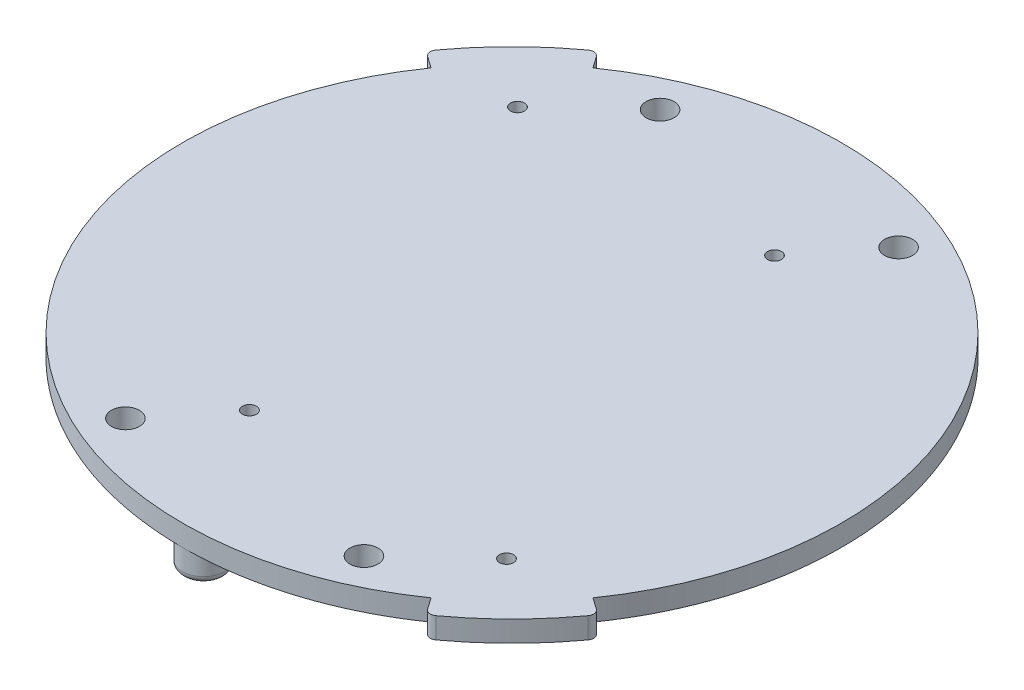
SolidWorks part; units mm, degrees
other "<a_base>-<Holes Pattern>"
ref_plane "Front Plane" through (0, 0, 0) normal (0, 0, 1) x (1, 0, 0)
ref_plane "Top Plane" through (0, 0, 0) normal (0, 1, 0) x (1, 0, 0)
ref_plane "Right Plane" through (0, 0, 0) normal (1, 0, 0) x (0, 0, -1)
inserted part "a_base"
sketch "Sketch1" plane through (0, -1.5, 0) normal (0, -1, 0) x (1, 0, 0)
  line L0 (27.5, 28.2843) -> (-9.1667, 28.2843) construction
  line L1 (9.1667, -28.2843) -> (-27.5, -28.2843) construction
  line L2 (9.1667, 28.2843) -> (-9.1667, -28.2843) construction
  line L3 (0, 0) -> (-44.7105, 14.4903) construction
  line L4 (0.1764, 16.7621) -> (-7.4339, 19.2286)
  line L5 (-7.4339, 19.2286) -> (-17.2996, -11.2127)
  line L6 (1.1013, 19.616) -> (-35.0366, 31.3279)
  line L7 (-20.1535, -10.2878) -> (-10.2878, 20.1535)
  line L8 (-10.2878, 20.1535) -> (-26.4596, 25.3946)
  line L9 (-26.4596, 25.3946) -> (-36.3254, -5.0466)
  line L10 (-39.1792, -4.1217) -> (-29.3135, 26.3195)
  line L11 (-29.3135, 26.3195) -> (-37.1072, 28.8454)
  line L12 (-7.4339, 19.2286) -> (-10.2878, 20.1535) construction
  line L13 (-26.4596, 25.3946) -> (-29.3135, 26.3195) construction
  line L14 (1.1013, 19.616) -> (0.1764, 16.7621)
  line L15 (-39.1792, -4.1217) -> (-46.9729, -1.5958)
  line L16 (-20.1535, -10.2878) -> (-36.3254, -5.0466)
  line L17 (-9.6893, -13.6791) -> (-17.2996, -11.2127)
  line L18 (-10.6142, -16.533) -> (-46.7521, -4.821)
  line L19 (-10.6142, -16.533) -> (-9.6893, -13.6791)
  circle A0 centre (0, 0) radius 47 construction
  arc A1 (-35.0366, 31.3279) -> (-37.1072, 28.8454) centre (0, 0) ccw
  arc A2 (-46.7521, -4.821) -> (-46.9729, -1.5958) centre (0, 0) cw
  point P30 (-34.2464, 11.0989)
  point P31 (-31.3925, 10.174)
  point P32 (-15.2206, 4.9329)
  point P33 (-12.3667, 4.0079)
  dimension "D1" = 3
  dimension "D2" = 16
  dimension "D3" = 23
  dimension "D4" = 36
  dimension "D5" = 8
extrude "Servo Standoff" add sketch "Sketch1" along normal blind 8 contours L18 L19 L17 L5 L4 L14 L6 L11 L10 L15 L7 L16 L9 L8 M12
sketch "Sketch3" plane through (5.8578, 0, 18.0745) normal (0.3083, 0, 0.9513) x (0.9513, 0, -0.3083)
  line L0 (-5, -1.5) -> (-5, -9.5)
  line L1 (-5, -9.5) -> (-13, -9.5)
  line L3 (-5, -9.5) -> (-42.9884, -9.5) construction
  line L4 (-36, -9.5) -> (-44.1928, -9.5)
  line L6 (-44, -1.5) -> (-44.1928, -1.5)
  line L7 (-44.1928, -1.5) -> (-44.1928, -9.5)
  line L8 (-5, -1.5) -> (-42.9884, -1.5) construction
  arc A0 (-5, -1.5) -> (-13, -9.5) centre (-5, -9.5) ccw
  arc A1 (-36, -9.5) -> (-44, -1.5) centre (-44, -9.5) ccw
  dimension "D1" = 23
extrude "Servo Standoff Side Cut" cut sketch "Sketch3" against normal through all
sketch "Sketch2" plane through (0, -1.5, 0) normal (0, -1, 0) x (1, 0, 0)
  line L0 (0, 0) -> (-12.3667, 4.0079) construction
  line L1 (-7.4339, 19.2286) -> (-17.2996, -11.2127) construction
  line L2 (-6.7823, 7.4541) -> (9.8653, 2.0588)
  line L3 (9.8653, 2.0588) -> (6.7823, -7.4541)
  line L4 (6.7823, -7.4541) -> (-9.8653, -2.0588)
  line L5 (-6.7823, 7.4541) -> (-9.8653, -2.0588)
  line L6 (0, 0) -> (-14.4903, -44.7105) construction
  line L7 (14.8332, 3.6024) -> (-9.9003, 11.6183)
  line L8 (-9.9003, 11.6183) -> (-14.8332, -3.6024)
  line L9 (-14.8332, -3.6024) -> (9.9003, -11.6183)
  line L10 (9.9003, -11.6183) -> (14.8332, 3.6024)
  arc A0 (-46.7521, -4.821) -> (-35.0366, 31.3279) centre (0, 0) ccw construction
  dimension "D1" = 10
  dimension "D2" = 17.5
  dimension "D3" = 3
extrude "Servo Top" add sketch "Sketch2" along normal blind 5
sketch "Sketch7" plane through (2.4664, 0, 7.6103) normal (0.3083, 0, 0.9513) x (0.9513, 0, -0.3083)
  line L0 (0, -1.5) -> (0, -6.5) construction
  line L1 (13, -1.5) -> (-13, -1.5) construction
  line L2 (-13, -6.5) -> (13, -6.5) construction
  line L3 (-13, -3.5) -> (0, -3.5)
  line L4 (-13, -6.5) -> (-13, -1.5) construction
  line L5 (-13, -3.5) -> (-13, -6.5)
  line L6 (0, -4) -> (13, -4) construction
  line L7 (13, -6.5) -> (13, -1.5) construction
  line L8 (6.5, -4) -> (6.5, -6.5) construction
  line L9 (-13, -6.5) -> (6.5, -6.5)
  arc A0 (0, -3.5) -> (6.5, -6.5) centre (0, -12.0417) cw
  dimension "D1" = 2
extrude "Servo Top Side Cut" cut sketch "Sketch7" against normal up to surface (16 mm away)
sketch "Sketch8" plane through (0, -6.5, 0) normal (0, -1, 0) x (1, 0, 0)
  circle A0 centre (9.8653, 2.0588) radius 0.5
  circle A1 centre (6.7823, -7.4541) radius 0.5
  circle A2 centre (-6.7823, 7.4541) radius 0.5
  circle A3 centre (-9.8653, -2.0588) radius 0.5
  dimension "D1" = 1
extrude "Allowance Holes" cut sketch "Sketch8" against normal up to surface (5 mm away)
fillet "Allowance Fillets" radius 1 12 edges at (-6.9364, -2.5, 6.9785) (-6.3066, -2.5, 7.2999) (-9.7111, -2.5, -1.5831) (-9.3896, -2.5, -2.2129) (6.3066, -4, -7.2999) (6.9364, -4, -6.9785) (9.7111, -4, 1.5831) (9.3896, -4, 2.2129) (9.9003, -4, -11.6183) (14.8332, -4, 3.6024) (4.1794, -6.5, -8.1873) (8.1873, -6.5, 4.1794)
sketch "Sketch11" plane through (0, -1.5, 0) normal (0, -1, 0) x (1, 0, 0)
  line L0 (17.0093, 38.128) -> (-17.0093, 38.128) construction
  line L1 (17.0093, -38.128) -> (-17.0093, -38.128) construction
  line L2 (0, 0) -> (47, 0) construction
  line L3 (0, 0) -> (0, 47) construction
  circle A1 centre (0, 44) radius 3
  circle A2 centre (0, -44) radius 3
  arc A3 (-46.7521, -4.821) -> (-35.0366, 31.3279) centre (0, 0) ccw construction
  dimension "D1" = 6
sketch "Sketch10" plane through (0, -9.5, 0) normal (0, -1, 0) x (1, 0, 0)
  line L0 (-6.509, 22.0824) -> (-28.3886, 29.1734)
  line L1 (-28.3886, 29.1734) -> (-29.3135, 26.3195)
  line L2 (-29.3135, 26.3195) -> (-7.4339, 19.2286)
  line L3 (-7.4339, 19.2286) -> (-6.509, 22.0824)
  line L4 (-18.2245, -14.0665) -> (-40.1041, -6.9755)
  line L5 (-40.1041, -6.9755) -> (-39.1792, -4.1217)
  line L6 (-39.1792, -4.1217) -> (-17.2996, -11.2127)
  line L7 (-17.2996, -11.2127) -> (-18.2245, -14.0665)
extrude "Servo Standoff Legs" add sketch "Sketch10" along normal blind 3
extrude "Shell Pins" add sketch "Sketch11" along normal blind 4
sketch "Sketch12" plane through (0, 1.5, 0) normal (0, 1, 0) x (1, 0, 0)
  line L0 (0, 0) -> (47, 0) construction
  line L1 (0, 0) -> (0, -47) construction
  line L2 (0, 0) -> (33.234, -33.234) construction
  line L3 (0, 0) -> (38.5001, -26.9581) construction
  line L4 (0, 0) -> (26.9581, -38.5001) construction
  line L5 (-38.5001, 26.9581) -> (-40.9576, 28.6788)
  line L6 (38.5001, -26.9581) -> (40.9576, -28.6788)
  line L7 (26.9581, -38.5001) -> (28.6788, -40.9576)
  line L8 (0, 0) -> (33.234, 33.234) construction
  line L9 (-26.9581, 38.5001) -> (-28.6788, 40.9576)
  circle A0 centre (0, 0) radius 47 construction
  arc A1 (28.6788, -40.9576) -> (40.9576, -28.6788) centre (0, 0) ccw
  arc A2 (26.9581, -38.5001) -> (38.5001, -26.9581) centre (0, 0) ccw
  arc A3 (-38.5001, 26.9581) -> (-26.9581, 38.5001) centre (0, 0) cw
  arc A4 (-40.9576, 28.6788) -> (-28.6788, 40.9576) centre (0, 0) cw
  dimension "D1" = 45
  dimension "D2" = 20
  dimension "D3" = 3
extrude "Allowance Extrude" add sketch "Sketch12" against normal up to surface (3 mm away) contours L7 A1 L6 M11 | A4 L5 L9 M11
fillet "Print FIllets" radius 1 6 edges at (0, -5.5, -41) (0, -5.5, 41) (-40.9576, 0, -28.6788) (-28.6788, 0, -40.9576) (28.6788, 0, 40.9576) (40.9576, 0, 28.6788)
equation "\"D1@Sketch1\"=\"width keep@values@params.sldprt\""
equation "\"D3@Sketch2\"=\"width keep@values@params.sldprt\""
equation "\"D1@Sketch11\"=2*\"width keep@values@params.sldprt\""
equation "\"D3@Sketch12\"=\"width keep@values@params.sldprt\""
